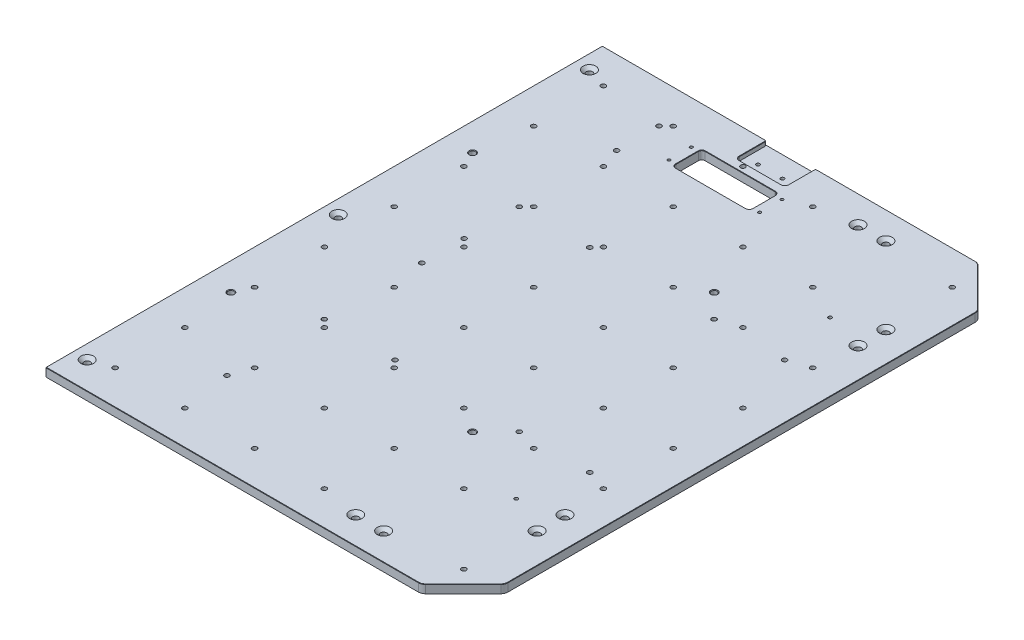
SolidWorks part; units mm, degrees
ref_plane "Ebene vorne" through (0, 0, 0) normal (0, 0, 1) x (1, 0, 0)
ref_plane "Ebene oben" through (0, 0, 0) normal (0, 1, 0) x (1, 0, 0)
ref_plane "Ebene rechts" through (0, 0, 0) normal (1, 0, 0) x (0, 0, -1)
sketch "Skizze1" plane through (0, 0, 0) normal (0, 1, 0) x (1, 0, 0)
  line L0 (-538, 399) -> (-598, 339)
  line L1 (-538, -399) -> (538, -399)
  line L2 (-538, -399) -> (-538, 399) construction
  line L3 (-538, 399) -> (538, 399)
  line L4 (538, -399) -> (538, 399) construction
  line L5 (-538, -399) -> (538, 399) construction
  line L6 (-538, 399) -> (538, -399) construction
  line L7 (-598, 339) -> (-598, -339)
  line L8 (-538, -399) -> (-598, -339)
  line L10 (538, -399) -> (598, -339)
  line L11 (598, -339) -> (598, 339)
  line L12 (598, 339) -> (538, 399)
  line L13 (-598, 0) -> (0, 0) construction
  point P0 (0, 0)
  dimension "D1" = 1196
  dimension "D2" = 798
  dimension "D3" = 60
  dimension "D4" = 45
extrude "Aufsatz-Linear austragen1" add sketch "Skizze1" along normal blind 12
fillet "Verrundung1" radius 10
hole_wizard "M8 Gewindebohrung2" positions "Skizze6" profile "Skizze7" tap size "M8" standard "DIN"
sketch "Skizze6" plane through (0, 12, 0) normal (0, 1, 0) x (1, 0, 0)
  line L1 (240.8464, -139.6536) -> (520.1536, -139.6536) construction
  line L2 (240.8464, -139.6536) -> (240.8464, 139.6536) construction
  line L3 (240.8464, 139.6536) -> (520.1536, 139.6536) construction
  line L4 (520.1536, -139.6536) -> (520.1536, 139.6536) construction
  line L5 (240.8464, -139.6536) -> (520.1536, 139.6536) construction
  line L6 (240.8464, 139.6536) -> (520.1536, -139.6536) construction
  line L7 (598, -334.8579) -> (598, 334.8579) construction
  circle A0 centre (380.5, 0) radius 197.5 construction
  point P5 (520.1536, 139.6536)
  point P8 (240.8464, -139.6536)
  point P9 (240.8464, 139.6536)
  point P10 (520.1536, -139.6536)
  dimension "D1" = 395
  dimension "D2" = 20
sketch "Skizze7" plane through (520.1536, 12, 139.6536) normal (1, 0, 0) x (0, 0, 1)
  line L0 (0, 0) -> (0, 12)
  line L1 (0, 12) -> (3.4, 12)
  line L2 (3.4, 12) -> (3.4, 0)
  line L5 (3.4, 0) -> (0, 0)
  line L11 (0, -6.35) -> (0, 107.95) construction
  dimension "Bohrerdurchmesser" = 6.8
  dimension "Bohrungstiefe" = 12
hole_wizard "M8 Gewindebohrung3" positions "Skizze9" profile "Skizze10" tap size "M8" standard "DIN"
sketch "Skizze9" plane through (0, 12, 0) normal (0, 1, 0) x (1, 0, 0)
  point P0 (-550, -350)
  dimension "D1" = 550
  dimension "D2" = 350
sketch "Skizze10" plane through (-550, 12, 350) normal (1, 0, 0) x (0, 0, 1)
  line L0 (0, 0) -> (0, 12)
  line L1 (0, 12) -> (3.4, 12)
  line L2 (3.4, 12) -> (3.4, 0)
  line L5 (3.4, 0) -> (0, 0)
  line L11 (0, -6.35) -> (0, 107.95) construction
  dimension "Bohrerdurchmesser" = 6.8
  dimension "Bohrungstiefe" = 12
pattern_linear "Lineares Muster1" count 12 spacing 100 count 8 spacing 100 of "M8 Gewindebohrung3"
sketch "Skizze16" plane through (0, 12, 0) normal (0, 1, 0) x (1, 0, 0)
  line L0 (0, 0) -> (0, 531.261) construction
  circle A0 centre (-450, 350) radius 6
  circle A1 centre (-550, 250) radius 6
  circle A2 centre (-450, -350) radius 6
  circle A3 centre (-550, -250) radius 6
  circle A4 centre (550, -250) radius 6
  circle A5 centre (450, -350) radius 6
  circle A6 centre (550, 250) radius 6
  circle A7 centre (450, 350) radius 6
  dimension "D1" = 12
extrude "Aufsatz-Linear austragen2" add sketch "Skizze16" against normal up to surface (12 mm away)
hole_wizard "Formsenkung für M8 Senkschraube mit Innensechskant1" positions "Skizze2" profile "Skizze3" countersink size "M8" standard "DIN"
sketch "Skizze2" plane through (0, 12, 0) normal (0, 1, 0) x (1, 0, 0)
  line L1 (445, -360) -> (-445, -360)
  line L2 (445, -360) -> (445, 360)
  line L3 (445, 360) -> (-445, 360)
  line L4 (-445, -360) -> (-445, 360)
  line L5 (445, -360) -> (-445, 360) construction
  line L6 (445, 360) -> (-445, -360) construction
  line L7 (0, 0) -> (-610.081, 0) construction
  line L8 (-555, 210) -> (-555, -210) construction
  line L13 (0, 0) -> (0, -385.3386) construction
  line L18 (555, 210) -> (555, -210) construction
  line L19 (-20, 360) -> (-20, -360)
  line L21 (20, 360) -> (20, -360)
  line L22 (-555, 250) -> (-555, 210) construction
  line L24 (-555, -210) -> (-555, -250) construction
  line L26 (555, -210) -> (555, -250) construction
  line L28 (555, 210) -> (555, 250) construction
  point P2 (-445, 360)
  point P5 (445, -360)
  point P6 (445, 360)
  point P7 (-445, -360)
  point P98 (-555, 210)
  point P100 (-555, -210)
  point P123 (555, 210)
  point P125 (555, -210)
  point P139 (-20, 360)
  point P142 (20, 360)
  point P145 (-20, -360)
  point P148 (20, -360)
  point P150 (-20, 0)
  point P152 (20, 0)
  point P174 (-555, 250)
  point P177 (-555, -250)
  point P180 (555, -250)
  point P183 (555, 250)
  point P184 (-405, 360)
  point P186 (405, 360)
  point P188 (405, -360)
  point P190 (-405, -360)
  dimension "D1" = 890
  dimension "D2" = 720
  dimension "D3" = 40
  dimension "D4" = 1110
  dimension "D5" = 500
  dimension "D6" = 40
  dimension "D7" = 40
  dimension "D8" = 40
  dimension "D9" = 40
  dimension "D10" = 40
sketch "Skizze3" plane through (-445, 12, -360) normal (1, 0, 0) x (0, 0, 1)
  line L0 (0, 0) -> (0, 12)
  line L1 (0, 12) -> (4.5, 12)
  line L2 (4.5, 12) -> (4.5, 4.625)
  line L3 (4.5, 4.625) -> (9.125, 0)
  line L5 (9.125, 0) -> (0, 0)
  line L6 (-4.5, 4.625) -> (-9.125, 0) construction
  line L11 (0, -6.35) -> (0, 107.95) construction
  dimension "Bohrerdurchmesser" = 9
  dimension "Bohrungstiefe" = 12
  dimension "Senkdurchmesser (Oben)" = 18.25
  dimension "Senkwinkel (Oben)" = 90
sketch "Skizze8" plane through (0, 12, 0) normal (0, 1, 0) x (1, 0, 0)
  line L1 (204, 300) -> (304, 300)
  line L2 (199, 305) -> (199, 337)
  line L3 (204, 342) -> (304, 342)
  line L4 (309, 305) -> (309, 337)
  line L5 (199, 300) -> (309, 342) construction
  line L6 (199, 342) -> (309, 300) construction
  arc A0 (199, 305) -> (204, 300) centre (204, 305) ccw
  arc A1 (304, 300) -> (309, 305) centre (304, 305) ccw
  arc A2 (309, 337) -> (304, 342) centre (304, 337) ccw
  arc A3 (204, 342) -> (199, 337) centre (204, 337) ccw
  point P0 (254, 321)
  dimension "D5" = 5
  dimension "D1" = 254
  dimension "D2" = 110
  dimension "D3" = 42
  dimension "D4" = 321
extrude "Schnitt-Linear austragen1" cut sketch "Skizze8" against normal through all
hole_wizard "M5 Gewindebohrung1" positions "Skizze17" profile "Skizze18" tap size "M5" standard "DIN"
sketch "Skizze17" plane through (0, 12, 0) normal (0, 1, 0) x (1, 0, 0)
  line L0 (254, 342) -> (254, 300) construction
  line L1 (304, 342) -> (204, 342) construction
  line L2 (204, 300) -> (304, 300) construction
  line L3 (199, 321) -> (254, 321) construction
  line L4 (199, 337) -> (199, 305) construction
  line L5 (254, 321) -> (309, 321) construction
  line L6 (309, 305) -> (309, 337) construction
  point P17 (189, 337)
  point P19 (189, 305)
  point P21 (319, 305)
  point P23 (319, 337)
  dimension "D1" = 32
  dimension "D2" = 130
sketch "Skizze18" plane through (319, 12, -337) normal (1, 0, 0) x (0, 0, 1)
  line L0 (0, 0) -> (0, 13.2618)
  line L1 (0, 13.2618) -> (2.1, 12)
  line L2 (2.1, 12) -> (2.1, 0)
  line L5 (2.1, 0) -> (0, 0)
  line L10 (0, 13.2618) -> (-2.1, 12) construction
  line L11 (0, -6.35) -> (0, 107.95) construction
  dimension "Bohrerdurchmesser" = 4.2
  dimension "Bohrungstiefe" = 12
  dimension "Spitzenwinkel" = 118
sketch "Skizze11" plane through (0, 12, 0) normal (0, 1, 0) x (1, 0, 0)
  line L0 (0, 0) -> (0, 417.1845) construction
  line L1 (533.8579, 399) -> (-533.8579, 399) construction
  line L2 (-270, 355) -> (-270, 399) construction
  line L3 (-305.1, 399) -> (-234.9, 399)
  line L4 (-305.1, 399) -> (-305.1, 360)
  line L5 (-300.1, 355) -> (-239.9, 355)
  line L6 (-234.9, 399) -> (-234.9, 360)
  line L7 (234.9, 399) -> (234.9, 360)
  line L8 (300.1, 355) -> (239.9, 355)
  line L9 (305.1, 399) -> (305.1, 360)
  line L10 (305.1, 399) -> (234.9, 399)
  arc A0 (-234.9, 360) -> (-239.9, 355) centre (-239.9, 360) cw
  arc A1 (-300.1, 355) -> (-305.1, 360) centre (-300.1, 360) cw
  arc A2 (300.1, 355) -> (305.1, 360) centre (300.1, 360) ccw
  arc A3 (234.9, 360) -> (239.9, 355) centre (239.9, 360) ccw
  point P12 (-234.9, 355)
  point P15 (-305.1, 355)
  point P25 (305.1, 355)
  point P26 (234.9, 355)
  dimension "D3" = 5
  dimension "D1" = 44
  dimension "D2" = 70.2
  dimension "D4" = 270
extrude "Schnitt-Linear austragen2" cut sketch "Skizze11" against normal blind 6
fillet "Verrundung2" radius 2
hole_wizard "M6 Gewindebohrung1" positions "Skizze12" profile "Skizze13" tap size "M6" standard "DIN"
sketch "Skizze12" plane through (0, 6, 0) normal (0, 1, 0) x (1, 0, 0)
  line L0 (-270, 95.0617) -> (-270, 369.2) construction
  line L1 (-270, 369.2) -> (-287.5, 369.2) construction
  line L3 (-270, 369.2) -> (-252.5, 369.2) construction
  line L6 (-300.1, 355) -> (-239.9, 355) construction
  line L7 (-270, 369.2) -> (-270, 399) construction
  line L8 (-232.9, 399) -> (-307.1, 399) construction
  point P0 (-287.5, 369.2)
  point P4 (-252.5, 369.2)
  dimension "D1" = 35
  dimension "D2" = 14.2
sketch "Skizze13" plane through (-287.5, 6, -369.2) normal (1, 0, 0) x (0, 0, 1)
  line L0 (0, 0) -> (0, 6)
  line L1 (0, 6) -> (2.5, 6)
  line L2 (2.5, 6) -> (2.5, 0)
  line L5 (2.5, 0) -> (0, 0)
  line L11 (0, -6.35) -> (0, 107.95) construction
  dimension "Bohrerdurchmesser" = 5
  dimension "Bohrungstiefe" = 6
mirror "Spiegeln3" about plane through (0, 0, 0) normal (1, 0, 0) of "M8 Gewindebohrung2"
mirror "Spiegeln2" about plane through (0, 0, 0) normal (1, 0, 0) of "M6 Gewindebohrung1"
hole_wizard "Ø5.0mm Stiftloch1" positions "Skizze14" profile "Skizze15" hole size "Ø5.0" standard "DIN"
sketch "Skizze14" plane through (0, 12, 0) normal (0, 1, 0) x (1, 0, 0)
  line L1 (-500, -225) -> (500, -225)
  line L2 (-500, -225) -> (-500, 225)
  line L3 (-500, 225) -> (500, 225)
  line L4 (500, -225) -> (500, 225)
  line L5 (-500, -225) -> (500, 225) construction
  line L6 (-500, 225) -> (500, -225) construction
  point P2 (500, 225)
  point P5 (-500, -225)
  point P6 (-500, 225)
  point P7 (500, -225)
  dimension "D1" = 1000
  dimension "D2" = 450
sketch "Skizze15" plane through (500, 12, -225) normal (1, 0, 0) x (0, 0, 1)
  line L0 (0, 0) -> (0, 9.5022)
  line L1 (0, 9.5022) -> (2.5, 8)
  line L2 (2.5, 8) -> (2.5, 0)
  line L5 (2.5, 0) -> (0, 0)
  line L10 (0, 9.5022) -> (-2.5, 8) construction
  line L11 (0, -6.35) -> (0, 107.95) construction
  dimension "Bohrerdurchmesser" = 5
  dimension "Bohrungstiefe" = 8
  dimension "Spitzenwinkel" = 118
chamfer "Fase1" distance 0.5 angle 45
split "Abspalten1" [suppressed] bodies to split 121
split "Abspalten2" trim tools "Ebene rechts" bodies to split 121 resulting bodies 123
hole_wizard "HORST900 Mitte M8 Gewindebohrung7" positions "Skizze21" profile "Skizze22" tap size "M8" standard "DIN"
sketch "Skizze21" plane through (0, 12, 0) normal (0, 1, 0) x (1, 0, 0)
  line L0 (0, -398.5) -> (0, 398.5) construction
  line L2 (-139.6536, 139.6536) -> (139.6536, 139.6536) construction
  line L3 (-139.6536, 139.6536) -> (-139.6536, -139.6536) construction
  line L4 (-139.6536, -139.6536) -> (139.6536, -139.6536) construction
  line L5 (139.6536, 139.6536) -> (139.6536, -139.6536) construction
  line L6 (-139.6536, 139.6536) -> (139.6536, -139.6536) construction
  line L7 (-139.6536, -139.6536) -> (139.6536, 139.6536) construction
  circle A0 centre (0, 0) radius 197.5 construction
  point P8 (139.6536, -139.6536)
  point P95 (-139.6536, 139.6536)
  point P96 (-139.6536, -139.6536)
  point P97 (139.6536, 139.6536)
  dimension "D1" = 395
sketch "Skizze22" plane through (139.6536, 12, -139.6536) normal (1, 0, 0) x (0, 0, 1)
  line L0 (0, 0) -> (0, 12)
  line L1 (0, 12) -> (3.4, 12)
  line L2 (3.4, 12) -> (3.4, 0)
  line L5 (3.4, 0) -> (0, 0)
  line L11 (0, -6.35) -> (0, 107.95) construction
  dimension "Bohrerdurchmesser" = 6.8
  dimension "Bohrungstiefe" = 12
pattern_linear "HORST900 Mitte Rechts M8 Gewindebohrung" count 2 spacing 279.31 of "HORST900 Mitte M8 Gewindebohrung7"
hole_wizard "HORST900 Mitte Vorne M8 Gewindebohrung9" positions "Skizze23" profile "Skizze24" tap size "M8" standard "DIN"
sketch "Skizze23" plane through (0, 12, 0) normal (0, 1, 0) x (1, 0, 0)
  line L0 (0, -398.5) -> (0, 398.5) construction
  line L2 (-139.6536, 0) -> (139.6536, 0) construction
  line L3 (-139.6536, 0) -> (-139.6536, -279.3072) construction
  line L4 (-139.6536, -279.3072) -> (139.6536, -279.3072) construction
  line L5 (139.6536, 0) -> (139.6536, -279.3072) construction
  line L6 (-139.6536, 0) -> (139.6536, -279.3072) construction
  line L7 (-139.6536, -279.3072) -> (139.6536, 0) construction
  circle A0 centre (0, -139.6536) radius 197.5 construction
  point P6 (139.6536, -279.3072)
  point P125 (-139.6536, 0)
  point P126 (-139.6536, -279.3072)
  point P127 (139.6536, 0)
  point P129 (0, 0)
  point P130 (0, 0)
  dimension "D1" = 395
sketch "Skizze24" plane through (139.6536, 12, 0) normal (1, 0, 0) x (0, 0, 1)
  line L0 (0, 0) -> (0, 12)
  line L1 (0, 12) -> (3.4, 12)
  line L2 (3.4, 12) -> (3.4, 0)
  line L5 (3.4, 0) -> (0, 0)
  line L11 (0, -6.35) -> (0, 107.95) construction
  dimension "Bohrerdurchmesser" = 6.8
  dimension "Bohrungstiefe" = 12
pattern_linear "Lineares Muster5" count 2 spacing 279.31 of "HORST900 Mitte Vorne M8 Gewindebohrung9"
pattern_linear "Lineares Muster6" count 2 spacing 340 of "HORST900 Mitte Vorne M8 Gewindebohrung9"
hole_wizard "HORST1400 M10 Gewindebohrung1" positions "Skizze25" profile "Skizze26" tap size "M10" standard "DIN"
sketch "Skizze25" plane through (0, 12, 0) normal (0, 1, 0) x (1, 0, 0)
  line L1 (39.2588, 173.2412) -> (385.7412, 173.2412) construction
  line L2 (39.2588, 173.2412) -> (39.2588, -173.2412) construction
  line L3 (39.2588, -173.2412) -> (385.7412, -173.2412) construction
  line L4 (385.7412, 173.2412) -> (385.7412, -173.2412) construction
  line L5 (0, 0) -> (212.5, 0) construction
  line L7 (0, -398.5) -> (0, 398.5) construction
  circle A0 centre (212.5, 0) radius 245 construction
  point P0 (39.2588, -173.2412)
  point P2 (39.2588, 173.2412)
  point P4 (385.7412, 173.2412)
  point P6 (385.7412, -173.2412)
  dimension "D1" = 490
  dimension "D2" = 212.5
sketch "Skizze26" plane through (39.2588, 12, 173.2412) normal (1, 0, 0) x (0, 0, 1)
  line L0 (0, 0) -> (0, 12)
  line L1 (0, 12) -> (4.25, 12)
  line L2 (4.25, 12) -> (4.25, 0.775)
  line L3 (4.25, 0.775) -> (5.025, 0)
  line L5 (5.025, 0) -> (0, 0)
  line L6 (-4.25, 0.775) -> (-5.025, 0) construction
  line L11 (0, -6.35) -> (0, 107.95) construction
  dimension "Bohrerdurchmesser" = 8.5
  dimension "Bohrungstiefe" = 12
  dimension "Senkdurchmesser (Oben)" = 10.05
  dimension "Senkwinkel (Oben)" = 90
